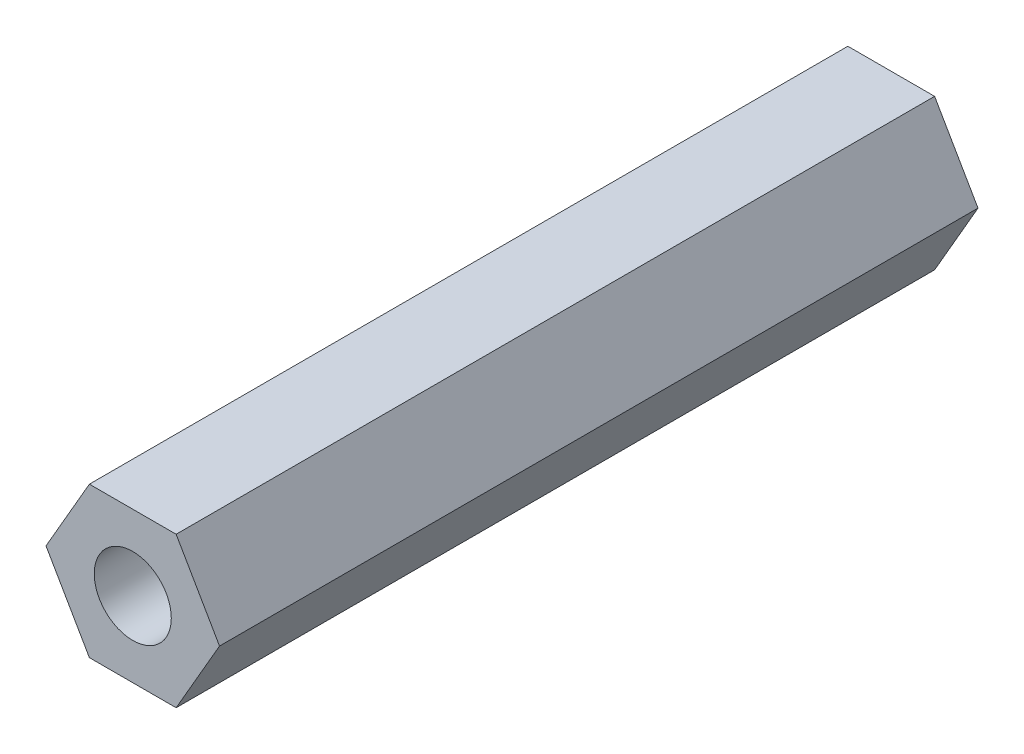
SolidWorks part; units mm, degrees
ref_plane "Front Plane" through (0, 0, 0) normal (0, 0, 1) x (1, 0, 0)
ref_plane "Top Plane" through (0, 0, 0) normal (0, 1, 0) x (1, 0, 0)
ref_plane "Right Plane" through (0, 0, 0) normal (1, 0, 0) x (0, 0, -1)
sketch "Sketch1" plane through (0, 0, 0) normal (0, 0, 1) x (1, 0, 0)
  line L1 (1.1438, 1.9812) -> (-1.1438, 1.9812)
  line L2 (-1.1438, 1.9812) -> (-2.2877, 0)
  line L3 (-2.2877, 0) -> (-1.1438, -1.9812)
  line L4 (-1.1438, -1.9812) -> (1.1438, -1.9812)
  line L5 (1.1438, -1.9812) -> (2.2877, 0)
  line L6 (2.2877, 0) -> (1.1438, 1.9812)
  circle A0 centre (0, 0) radius 1.9812 construction
  dimension "D1" = 3.9624
extrude "Boss-Extrude1" add sketch "Sketch1" along normal mid plane 20
sketch "Sketch5" plane through (0, 0, 10) normal (0, 0, 1) x (1, 0, 0)
  circle A0 centre (0, 0) radius 1.016
  dimension "D1" = 2.032
extrude "Cut-Extrude1" cut sketch "Sketch5" against normal through all both and the other way through all
